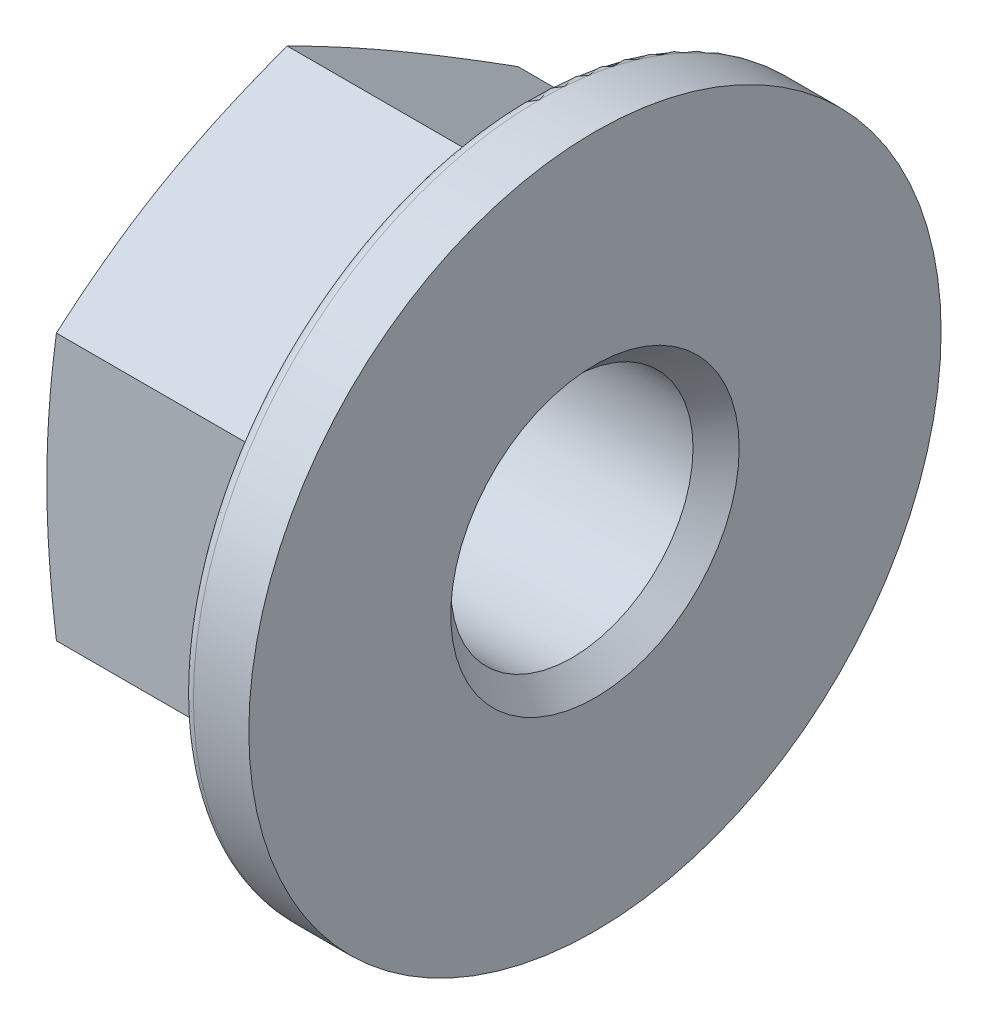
SolidWorks part; units mm, degrees
ref_plane "正面" through (0, 0, 0) normal (0, 0, 1) x (1, 0, 0)
ref_plane "平面" through (0, 0, 0) normal (0, 1, 0) x (1, 0, 0)
ref_plane "右側面" through (0, 0, 0) normal (1, 0, 0) x (0, 0, -1)
imported_body "ｲﾝﾎﾟｰﾄ1"
sketch "ｽｹｯﾁ1" plane through (0, 0, 0) normal (0, 1, 0) x (1, 0, 0)
  line L0 (-1.1, 6) -> (-2.2647, 2.8)
  line L1 (-2.2647, 2.8) -> (-1.1, 2.8)
  line L2 (-1.1, 4) -> (-1.1, 0) construction
  line L3 (-1.1, 2.8) -> (-1.1, 6)
  line L4 (-5.067, 0) -> (-0.433, 0) construction
  point P3 (-1.8257, 2.9288)
  dimension "D1" = 20
  dimension "D2" = 2.8
revolve "回転1" add sketch "ｽｹｯﾁ1" angle 360
fillet "ﾌｨﾚｯﾄ1" radius 0.2 7 edges at (-1.1, 0, -6)
hole_wizard "M5x0.8 ねじ穴1" positions "ｽｹｯﾁ2" profile "ｽｹｯﾁ3" tap size "M5x0.8" standard "JIS"
sketch "ｽｹｯﾁ2" plane through (-5.5, 0, 0) normal (-1, 0, 0) x (0, 0, 1)
  point P0 (0, 0)
sketch "ｽｹｯﾁ3" plane through (-5.5, 0, 0) normal (0, 1, 0) x (0, 0, 1)
  line L0 (0, 0) -> (0, 5.5)
  line L1 (0, 5.5) -> (2.1, 5.5)
  line L2 (2.1, 5.5) -> (2.1, 0)
  line L5 (2.1, 0) -> (0, 0)
  line L11 (0, -6.35) -> (0, 107.95) construction
  dimension "次ｻｰﾌｪｽまでのねじ下穴ﾄﾞﾘﾙ直径" = 4.2
  dimension "次ｻｰﾌｪｽまでのねじ下穴ﾄﾞﾘﾙの深さ" = 5.5
